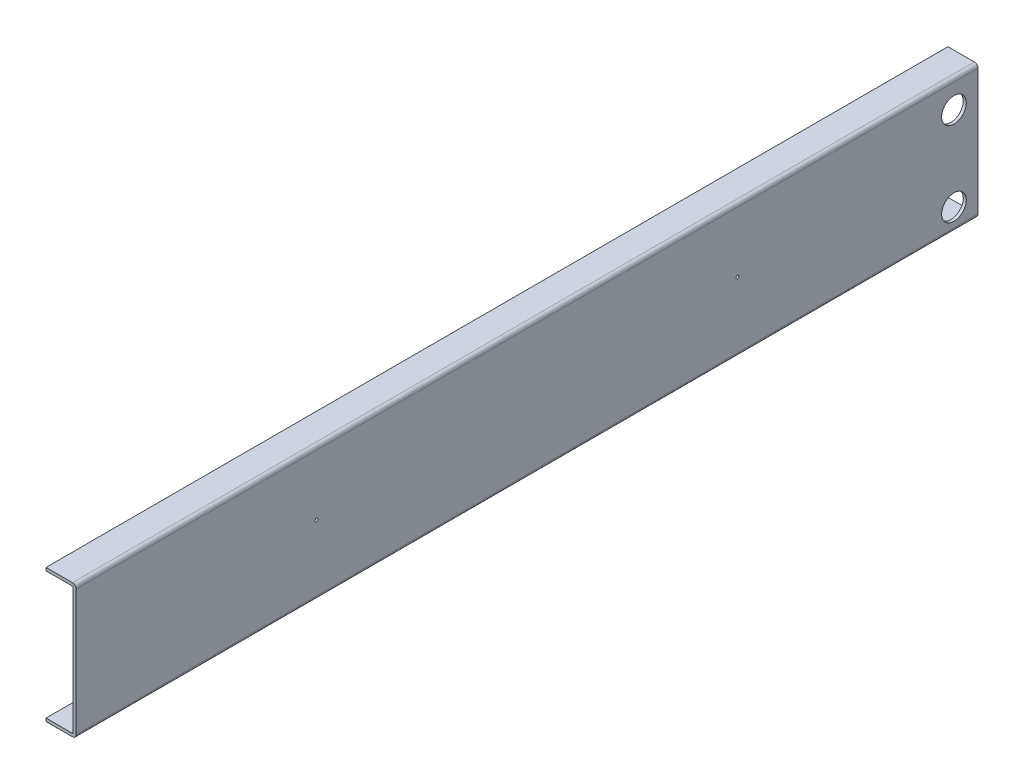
SolidWorks part; units mm, degrees
ref_plane "Face" through (0, 0, 0) normal (0, 0, 1) x (1, 0, 0)
ref_plane "Dessus" through (0, 0, 0) normal (0, 1, 0) x (1, 0, 0)
ref_plane "Droite" through (0, 0, 0) normal (1, 0, 0) x (0, 0, -1)
sketch "Esquisse1" plane through (0, 0, 0) normal (0, 0, 1) x (1, 0, 0)
  line L0 (0, 0) -> (44, 0)
  line L1 (50, -6) -> (50, -216)
  line L2 (44, -222) -> (0, -222)
  line L3 (0, 0) -> (0, -5)
  line L4 (0, -222) -> (0, -217)
  line L5 (0, -5) -> (44, -5)
  line L6 (0, -217) -> (44, -217)
  line L7 (45, -6) -> (45, -216)
  arc A0 (50, -6) -> (44, 0) centre (44, -6) ccw
  arc A1 (44, -222) -> (50, -216) centre (44, -216) ccw
  arc A2 (44, -217) -> (45, -216) centre (44, -216) ccw
  arc A3 (45, -6) -> (44, -5) centre (44, -6) ccw
  point P7 (50, 0)
  point P10 (50, -222)
  dimension "D3" = 6
  dimension "D1" = 50
  dimension "D2" = 222
  dimension "D4" = 5
  dimension "D6" = 5
  dimension "D5" = 5
extrude "Base-Extrusion" add sketch "Esquisse1" along normal blind 1500
sketch "Esquisse2" plane through (50, 0, 0) normal (1, 0, 0) x (0, 0, -1)
  line L0 (0, -216) -> (0, -6) construction
  line L1 (-1500, -222) -> (0, -222) construction
  line L2 (-1500, -216) -> (-1500, -6) construction
  circle A0 centre (-40, -46) radius 20.5
  circle A1 centre (-40, -186) radius 20.5
  circle A2 centre (-400, -106.7837) radius 2.5
  circle A3 centre (-1100, -106.7837) radius 2.5
  dimension "D1" = 41
  dimension "D7" = 5
  dimension "D2" = 40
  dimension "D3" = 140
  dimension "D4" = 36
  dimension "D5" = 400
  dimension "D6" = 1100
extrude "Enlèv. mat.-Extru.1" cut sketch "Esquisse2" against normal blind 10
